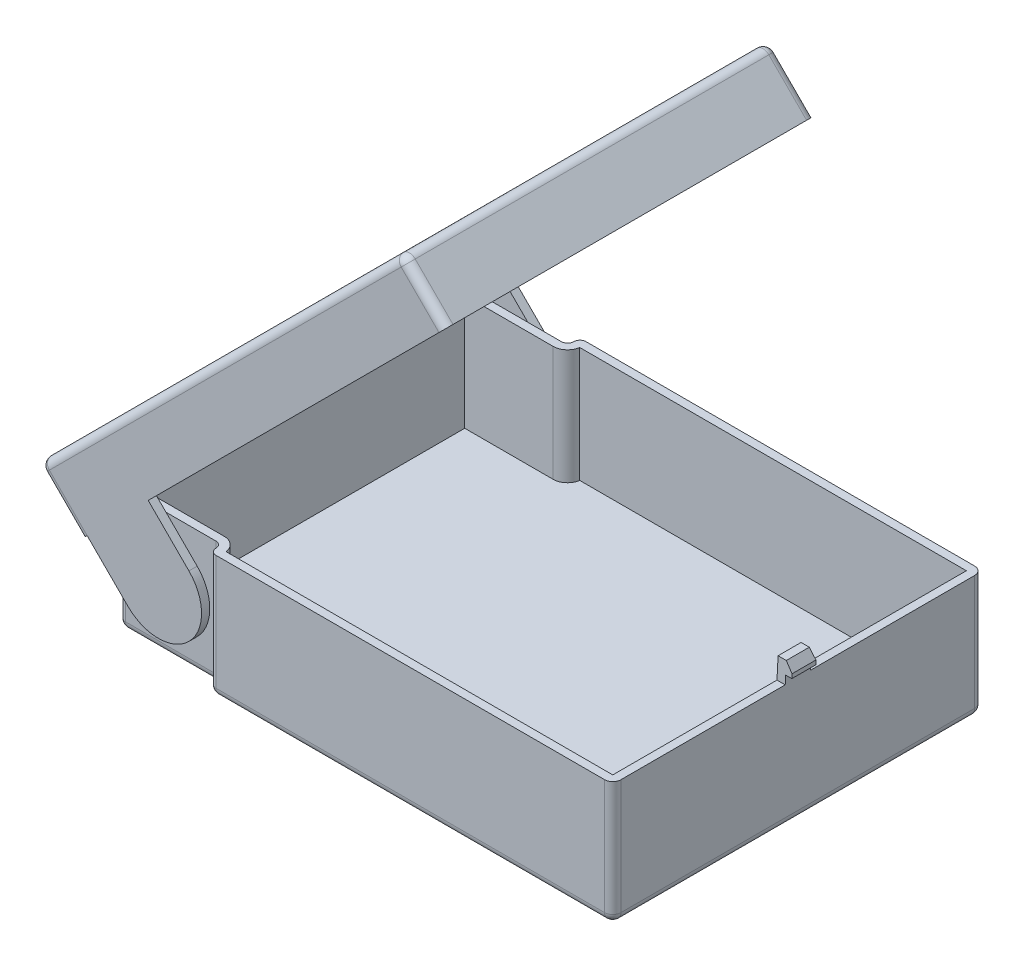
SolidWorks part; units mm, degrees
other "<Figure 11-54-2>-<Stock-Figure 11-59-1>"
ref_plane "Front Plane" through (0, 0, 0) normal (0, 0, 1) x (1, 0, 0)
ref_plane "Top Plane" through (0, 0, 0) normal (0, 1, 0) x (1, 0, 0)
ref_plane "Right Plane" through (0, 0, 0) normal (1, 0, 0) x (0, 0, -1)
sketch "Sketch1" plane through (0, 0, 0) normal (0, 1, 0) x (1, 0, 0)
  line L0 (-36.5, 45) -> (-36.5, 42)
  line L1 (-36.5, -45) -> (61.5, -45)
  line L2 (-61.5, -42) -> (-61.5, 42)
  line L3 (-36.5, 45) -> (61.5, 45)
  line L4 (61.5, -45) -> (61.5, 45)
  line L5 (-36.5, 42) -> (-61.5, 42)
  line L6 (-61.5, 0) -> (61.5, 0) construction
  line L8 (-36.5, -42) -> (-61.5, -42)
  line L9 (-36.5, -45) -> (-36.5, -42)
  dimension "D1" = 123
  dimension "D2" = 3
  dimension "D3" = 90
  dimension "D4" = 25
extrude "Extrude1" add sketch "Sketch1" along normal blind 30
fillet "Fillet1" radius 1.5 6 edges at (-36.5, 15, -45) (-36.5, 15, 45) (-36.5, 15, -42) (-61.5, 15, -42) (-61.5, 15, 42) (-36.5, 15, 42)
fillet "Fillet3" radius 2 2 edges at (61.5, 15, -45) (61.5, 15, 45)
fillet "Fillet2" radius 2 14 edges at (12.25, 0, -45) (-36.0607, 0, -44.5607) (-36.9393, 0, -42.4393) (-49, 0, -42) (-61.0607, 0, -41.5607) (-61.5, 0, 0) (-61.0607, 0, 41.5607) (-49, 0, 42) (-36.9393, 0, 42.4393) (-36.0607, 0, 44.5607) (61.5, 0, 0) (12.25, 0, 45) (60.9142, 0, -44.4142) (60.9142, 0, 44.4142)
shell "Shell1" thickness 2
sketch "Sketch2" plane through (0, 0, 42) normal (0, 0, 1) x (1, 0, 0)
  line L0 (-60, 30) -> (-38, 2) construction
  circle A0 centre (-49, 16) radius 1.25
  dimension "D1" = 2.5
extrude "Extrude2" add sketch "Sketch2" along normal blind 2
mirror "Mirror1" about plane through (0, 0, 0) normal (0, 0, 1) of "Extrude2"
sketch3d "3DSketch1"
  point P0 (61.5, 30, 0)
other "Snap Hook1" parameters "BaseDepth"=2, "TopDepth"=2, "Width"=5.6, "HookHeight"=3, "Overhang"=1.5, "BodyHeight"=2, "Draft"=3, "LipHeight"=1
inserted part "Figure 11-54-2"
move or copy body "Body-Move/Copy2" placed by mates yes
other "Distance2" parameters "D1"=1
